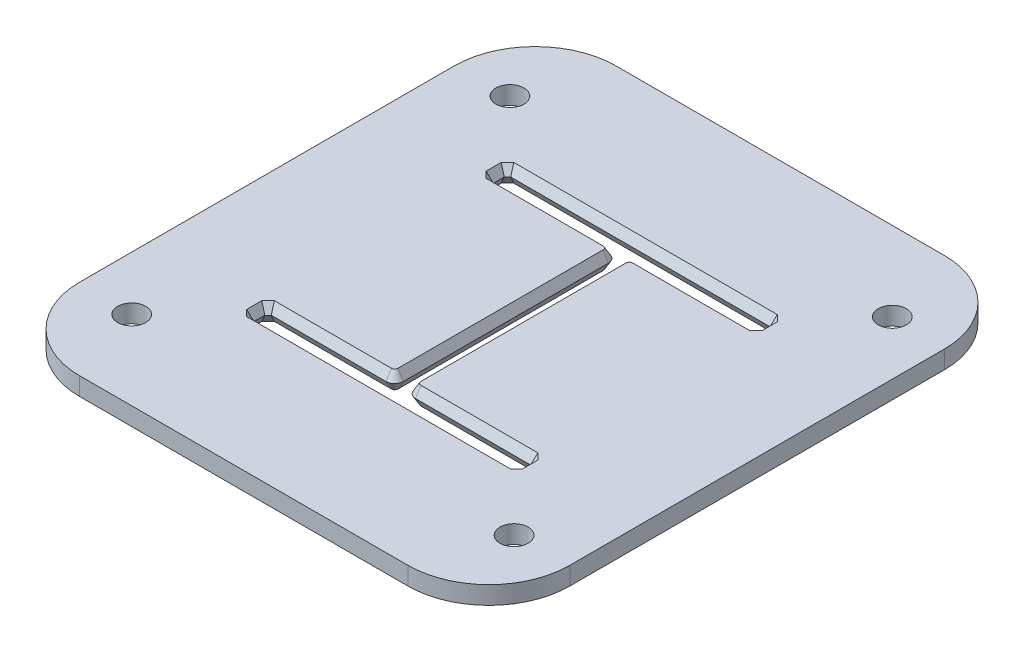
SolidWorks part; units mm, degrees
ref_plane "Front Plane" through (0, 0, 0) normal (0, 0, 1) x (1, 0, 0)
ref_plane "Top Plane" through (0, 0, 0) normal (0, 1, 0) x (1, 0, 0)
ref_plane "Right Plane" through (0, 0, 0) normal (1, 0, 0) x (0, 0, -1)
sketch "w14x665 hole layout" plane through (0, 0, 0) normal (0, 1, 0) x (1, 0, 0)
  point P0 (0, 0)
  line B0 (-308.3103, 362.8701) -> (308.3103, -362.8701) construction
  circle B1 centre (-308.3103, 362.8701) radius 45.2438
  circle B2 centre (0, 400.2851) radius 45.2437
  circle B3 centre (308.3103, 362.8701) radius 45.2438
  circle B4 centre (-308.3103, -362.8701) radius 45.2438
  circle B5 centre (0, -400.2851) radius 45.2437
  circle B6 centre (-161.3981, 0) radius 45.2438
  circle B7 centre (161.3981, 0) radius 45.2438
  circle B8 centre (308.3103, -362.8701) radius 45.2438
  line B9 (-308.3103, -362.8701) -> (308.3103, -362.8701) construction
sketch_block_instance "Block1-1"
sketch_block "Block1" parameters "D1"=90.4875, "D2"=90.4875, "D3"=90.4875, "D4"=90.4875, "D5"=90.4875, "D6"=90.4875, "D7"=90.4875, "D8"=90.4875
sketch "sk w14x550" plane through (0, 0, 0) normal (0, 1, 0) x (1, 0, 0)
  point P0 (-218.44, -257.048)
  line B0 (-218.44, -257.048) -> (-218.44, -160.02)
  line B1 (-218.44, -160.02) -> (-45.466, -160.02)
  line B2 (-30.226, -144.78) -> (-30.226, 144.78)
  line B3 (-45.466, 160.02) -> (-218.44, 160.02)
  line B4 (-218.44, 160.02) -> (-218.44, 257.048)
  line B5 (-218.44, 257.048) -> (218.44, 257.048)
  line B6 (218.44, 257.048) -> (218.44, 160.02)
  line B7 (218.44, 160.02) -> (45.466, 160.02)
  line B8 (30.226, 144.78) -> (30.226, -144.78)
  line B9 (45.466, -160.02) -> (218.44, -160.02)
  line B10 (218.44, -160.02) -> (218.44, -257.048)
  line B11 (218.44, -257.048) -> (-218.44, -257.048)
  line B12 (0, -257.048) -> (0, 257.048) construction
  arc B13 (-45.466, -160.02) -> (-30.226, -144.78) centre (-45.466, -144.78) ccw
  arc B14 (-30.226, 144.78) -> (-45.466, 160.02) centre (-45.466, 144.78) ccw
  arc B15 (45.466, 160.02) -> (30.226, 144.78) centre (45.466, 144.78) ccw
  arc B16 (30.226, -144.78) -> (45.466, -160.02) centre (45.466, -144.78) ccw
sketch_block_instance "W14x550-1"
sketch_block "W14x550" parameters "D6"=15.24, "D1"=60.452, "D2"=436.88, "D3"=514.096, "D4"=97.028, "D5"=97.028, "D7"=30.226
sketch "sk w455"
sketch_block_instance "W14x455-1"
sketch_block "W14x455" parameters "D6"=15.24, "D1"=51.181, "D2"=427.609, "D3"=483.108, "D4"=81.534, "D5"=81.534, "D7"=25.5905
sketch "sk w370" plane through (0, 0, 0) normal (0, 1, 0) x (1, 0, 0)
  line L0 (-209.2325, 227.584) -> (209.2325, -227.584) construction
  point P2 (0, 0)
  line B0 (-209.2325, -227.584) -> (-209.2325, -160.02)
  line B1 (-209.2325, -160.02) -> (-36.2585, -160.02)
  line B2 (-21.0185, -144.78) -> (-21.0185, 144.78)
  line B3 (-36.2585, 160.02) -> (-209.2325, 160.02)
  line B4 (-209.2325, 160.02) -> (-209.2325, 227.584)
  line B5 (-209.2325, 227.584) -> (209.2325, 227.584)
  line B6 (209.2325, 227.584) -> (209.2325, 160.02)
  line B7 (209.2325, 160.02) -> (36.2585, 160.02)
  line B8 (21.0185, 144.78) -> (21.0185, -144.78)
  line B9 (36.2585, -160.02) -> (209.2325, -160.02)
  line B10 (209.2325, -160.02) -> (209.2325, -227.584)
  line B11 (209.2325, -227.584) -> (-209.2325, -227.584)
  line B12 (0, -406.2251) -> (0, 227.584) construction
  arc B13 (-36.2585, -160.02) -> (-21.0185, -144.78) centre (-36.2585, -144.78) ccw
  arc B14 (-21.0185, 144.78) -> (-36.2585, 160.02) centre (-36.2585, 144.78) ccw
  arc B15 (36.2585, 160.02) -> (21.0185, 144.78) centre (36.2585, 144.78) ccw
  arc B16 (21.0185, -144.78) -> (36.2585, -160.02) centre (36.2585, -144.78) ccw
sketch_block_instance "W14x370-1"
sketch_block "W14x370" parameters "D6"=15.24, "D1"=42.037, "D2"=418.465, "D3"=455.168, "D4"=67.564, "D5"=67.564, "D7"=21.0185
sketch "sk w283" plane through (0, 0, 0) normal (0, 1, 0) x (1, 0, 0)
  line L0 (-204.597, 212.598) -> (204.597, -212.598) construction
  point P2 (0, 0)
  line B0 (-204.597, -212.598) -> (-204.597, -160.02)
  line B1 (-204.597, -160.02) -> (-31.623, -160.02)
  line B2 (-16.383, -144.78) -> (-16.383, 144.78)
  line B3 (-31.623, 160.02) -> (-204.597, 160.02)
  line B4 (-204.597, 160.02) -> (-204.597, 212.598)
  line B5 (-204.597, 212.598) -> (204.597, 212.598)
  line B6 (204.597, 212.598) -> (204.597, 160.02)
  line B7 (204.597, 160.02) -> (31.623, 160.02)
  line B8 (16.383, 144.78) -> (16.383, -144.78)
  line B9 (31.623, -160.02) -> (204.597, -160.02)
  line B10 (204.597, -160.02) -> (204.597, -212.598)
  line B11 (204.597, -212.598) -> (-204.597, -212.598)
  line B12 (0, -296.4001) -> (0, 212.598) construction
  arc B13 (-31.623, -160.02) -> (-16.383, -144.78) centre (-31.623, -144.78) ccw
  arc B14 (-16.383, 144.78) -> (-31.623, 160.02) centre (-31.623, 144.78) ccw
  arc B15 (31.623, 160.02) -> (16.383, 144.78) centre (31.623, 144.78) ccw
  arc B16 (16.383, -144.78) -> (31.623, -160.02) centre (31.623, -144.78) ccw
sketch_block_instance "W14x283-1"
sketch_block "W14x283" parameters "D6"=15.24, "D1"=32.766, "D2"=409.194, "D3"=425.196, "D4"=52.578, "D5"=52.578, "D7"=16.383
sketch "sk w193" plane through (0, 0, 0) normal (0, 1, 0) x (1, 0, 0)
  line B0 (-199.517, -196.596) -> (-199.517, -160.02)
  line B1 (-199.517, -160.02) -> (-26.543, -160.02)
  line B2 (-11.303, -144.78) -> (-11.303, 144.78)
  line B3 (-26.543, 160.02) -> (-199.517, 160.02)
  line B4 (-199.517, 160.02) -> (-199.517, 196.596)
  line B5 (-199.517, 196.596) -> (199.517, 196.596)
  line B6 (199.517, 196.596) -> (199.517, 160.02)
  line B7 (199.517, 160.02) -> (26.543, 160.02)
  line B8 (11.303, 144.78) -> (11.303, -144.78)
  line B9 (26.543, -160.02) -> (199.517, -160.02)
  line B10 (199.517, -160.02) -> (199.517, -196.596)
  line B11 (199.517, -196.596) -> (-199.517, -196.596)
  line B12 (0, -196.596) -> (0, 196.596) construction
  arc B13 (-26.543, -160.02) -> (-11.303, -144.78) centre (-26.543, -144.78) ccw
  arc B14 (-11.303, 144.78) -> (-26.543, 160.02) centre (-26.543, 144.78) ccw
  arc B15 (26.543, 160.02) -> (11.303, 144.78) centre (26.543, 144.78) ccw
  arc B16 (11.303, -144.78) -> (26.543, -160.02) centre (26.543, -144.78) ccw
sketch_block_instance "W14x193-1"
sketch_block "W14x193" parameters "D6"=15.24, "D1"=22.606, "D2"=399.034, "D3"=393.192, "D4"=36.576, "D5"=36.576, "D7"=11.303
sketch "sk w90"
sketch_block_instance "w14x90-1"
sketch_block "w14x90"
sketch "hole pattern" plane through (0, 0, 0) normal (0, 1, 0) x (1, 0, 0)
  circle A1 centre (269.9222, 267.0012) radius 76.2 construction
  circle A2 centre (-269.9222, -267.0012) radius 76.2 construction
  circle A3 centre (0, 302.5612) radius 76.2 construction
  circle A4 centre (0, -302.5612) radius 76.2 construction
  circle A5 centre (-161.544, 0) radius 76.2 construction
  circle A6 centre (161.544, 0) radius 76.2 construction
  line B0 (-269.9222, 267.0012) -> (-193.7222, 267.0012)
  line B1 (-269.9222, 267.0012) -> (-199.517, 196.596)
  circle B2 centre (-269.9222, 267.0012) radius 76.2 construction
  line B3 (269.9222, -267.0012) -> (193.7222, -267.0012)
  circle B4 centre (269.9222, -267.0012) radius 76.2 construction
  dimension "D1" = 152.4
  dimension "D2" = 152.4
  dimension "D3" = 152.4
  dimension "D4" = 152.4
  dimension "D7" = 152.4
  dimension "D8" = 152.4
  dimension "D5" = 35.56
  dimension "D6" = 35.56
  dimension "D9" = 161.544
  dimension "D10" = 323.088
sketch_block_instance "Block3-1"
sketch_block "Block3" parameters "D1"=152.4, "D2"=45, "D3"=99.568
sketch_block_instance "Block3-2"
sketch "Sketch2" plane through (0, 0, 0) normal (0, 1, 0) x (1, 0, 0)
  line L0 (-218.8845, 238.2701) -> (-210.5206, 246.634)
  line L1 (210.5206, 246.634) -> (218.8845, 238.2701)
  line L2 (-218.8845, 163.3039) -> (-210.5206, 154.94)
  line L3 (210.5206, 154.94) -> (218.8845, 163.3039)
  line L4 (210.5206, -154.94) -> (218.8845, -163.3039)
  line L5 (218.8845, -238.2701) -> (210.5206, -246.634)
  line L6 (-210.5206, -154.94) -> (-218.8845, -163.3039)
  line L7 (-218.8845, -238.2701) -> (-210.5206, -246.634)
  line L20 (-213.8045, 241.554) -> (213.8045, 241.554) construction
  line L34 (218.8845, -246.634) -> (218.8845, -154.94)
  line L35 (-218.8845, -154.94) -> (-218.8845, -246.634)
  line L48 (-218.8845, -246.634) -> (218.8845, -246.634)
  line L49 (218.8845, -154.94) -> (40.8305, -154.94)
  line L50 (-40.8305, -154.94) -> (-218.8845, -154.94)
  line L51 (30.6705, -144.78) -> (30.6705, 144.78)
  line L52 (-30.6705, 144.78) -> (-30.6705, -144.78)
  line L53 (-218.8845, 154.94) -> (-40.8305, 154.94)
  line L54 (-218.8845, 246.634) -> (-218.8845, 154.94)
  line L55 (218.8845, 246.634) -> (-218.8845, 246.634)
  line L56 (218.8845, 154.94) -> (218.8845, 246.634)
  line L57 (40.8305, 154.94) -> (218.8845, 154.94)
  line L58 (218.8845, -238.2701) -> (218.8845, -163.3039)
  line L59 (-218.8845, -163.3039) -> (-218.8845, -238.2701)
  line L60 (-210.5206, -246.634) -> (210.5206, -246.634)
  line L61 (210.5206, -154.94) -> (40.8305, -154.94)
  line L62 (-40.8305, -154.94) -> (-210.5206, -154.94)
  line L63 (30.6705, -144.78) -> (30.6705, 144.78)
  line L64 (-30.6705, 144.78) -> (-30.6705, -144.78)
  line L65 (-210.5206, 154.94) -> (-40.8305, 154.94)
  line L66 (-218.8845, 238.2701) -> (-218.8845, 163.3039)
  line L67 (210.5206, 246.634) -> (-210.5206, 246.634)
  line L68 (218.8845, 163.3039) -> (218.8845, 238.2701)
  line L69 (40.8305, 154.94) -> (210.5206, 154.94)
  arc A16 (30.6705, -144.78) -> (40.8305, -154.94) centre (40.8305, -144.78) ccw
  arc A17 (-40.8305, -154.94) -> (-30.6705, -144.78) centre (-40.8305, -144.78) ccw
  arc A18 (-30.6705, 144.78) -> (-40.8305, 154.94) centre (-40.8305, 144.78) ccw
  arc A19 (40.8305, 154.94) -> (30.6705, 144.78) centre (40.8305, 144.78) ccw
  arc A20 (30.6705, -144.78) -> (40.8305, -154.94) centre (40.8305, -144.78) ccw
  arc A21 (-40.8305, -154.94) -> (-30.6705, -144.78) centre (-40.8305, -144.78) ccw
  arc A22 (-30.6705, 144.78) -> (-40.8305, 154.94) centre (-40.8305, 144.78) ccw
  arc A23 (40.8305, 154.94) -> (30.6705, 144.78) centre (40.8305, 144.78) ccw
  dimension "D2" = 5.08
  dimension "D3" = 1.27
  dimension "D4" = 1.27
  dimension "D5" = 1.27
  dimension "D6" = 1.27
  dimension "D7" = 1.27
  dimension "D8" = 1.27
  dimension "D9" = 1.27
  dimension "D10" = 1.27
  dimension "D11" = 45
sketch "Sketch4" plane through (0, 0, 0) normal (0, 1, 0) x (1, 0, 0)
  line L1 (-403.008, 494.9829) -> (403.008, 494.9829)
  line L2 (-403.008, 494.9829) -> (-403.008, -494.9829)
  line L3 (-403.008, -494.9829) -> (403.008, -494.9829)
  line L4 (403.008, 494.9829) -> (403.008, -494.9829)
  point P4 (-403.008, 0)
  point P5 (0, 494.9829)
  dimension "D1" = 989.9658
  dimension "D2" = 806.016
extrude "Boss-Extrude1" add sketch "Sketch4" along normal mid plane 25.4
extrude "W455" [suppressed] cut sketch "Sketch2" against normal mid plane 63.5 draft 30
sketch "Sketch13" plane through (0, 0, 0) normal (0, 1, 0) x (1, 0, 0)
  line L12 (-214.3125, 224.3001) -> (-205.9486, 232.664)
  line L13 (205.9486, 232.664) -> (214.3125, 224.3001)
  line L14 (-214.3125, 163.3039) -> (-205.9486, 154.94)
  line L15 (205.9486, 154.94) -> (214.3125, 163.3039)
  line L16 (-205.9486, -154.94) -> (-214.3125, -163.3039)
  line L17 (-214.3125, -224.3001) -> (-205.9486, -232.664)
  line L18 (205.9486, -154.94) -> (214.3125, -163.3039)
  line L19 (214.3125, -224.3001) -> (205.9486, -232.664)
  line L24 (214.3125, -232.664) -> (214.3125, -154.94)
  line L25 (214.3125, -154.94) -> (36.2585, -154.94)
  line L26 (-214.3125, -232.664) -> (214.3125, -232.664)
  line L27 (-214.3125, -154.94) -> (-214.3125, -232.664)
  line L28 (-36.2585, -154.94) -> (-214.3125, -154.94)
  line L29 (26.0985, -144.78) -> (26.0985, 144.78)
  line L30 (-26.0985, 144.78) -> (-26.0985, -144.78)
  line L31 (-214.3125, 154.94) -> (-36.2585, 154.94)
  line L32 (-214.3125, 232.664) -> (-214.3125, 154.94)
  line L33 (214.3125, 232.664) -> (-214.3125, 232.664)
  line L34 (214.3125, 154.94) -> (214.3125, 232.664)
  line L35 (36.2585, 154.94) -> (214.3125, 154.94)
  line L36 (214.3125, -224.3001) -> (214.3125, -163.3039)
  line L37 (205.9486, -154.94) -> (36.2585, -154.94)
  line L38 (-205.9486, -232.664) -> (205.9486, -232.664)
  line L39 (-214.3125, -163.3039) -> (-214.3125, -224.3001)
  line L40 (-36.2585, -154.94) -> (-205.9486, -154.94)
  line L41 (26.0985, -144.78) -> (26.0985, 144.78)
  line L42 (-26.0985, 144.78) -> (-26.0985, -144.78)
  line L43 (-205.9486, 154.94) -> (-36.2585, 154.94)
  line L44 (-214.3125, 224.3001) -> (-214.3125, 163.3039)
  line L45 (205.9486, 232.664) -> (-205.9486, 232.664)
  line L46 (214.3125, 163.3039) -> (214.3125, 224.3001)
  line L47 (36.2585, 154.94) -> (205.9486, 154.94)
  arc A8 (26.0985, -144.78) -> (36.2585, -154.94) centre (36.2585, -144.78) ccw
  arc A9 (-36.2585, -154.94) -> (-26.0985, -144.78) centre (-36.2585, -144.78) ccw
  arc A10 (36.2585, 154.94) -> (26.0985, 144.78) centre (36.2585, 144.78) ccw
  arc A11 (-26.0985, 144.78) -> (-36.2585, 154.94) centre (-36.2585, 144.78) ccw
  arc A12 (26.0985, -144.78) -> (36.2585, -154.94) centre (36.2585, -144.78) ccw
  arc A13 (-36.2585, -154.94) -> (-26.0985, -144.78) centre (-36.2585, -144.78) ccw
  arc A14 (36.2585, 154.94) -> (26.0985, 144.78) centre (36.2585, 144.78) ccw
  arc A15 (-26.0985, 144.78) -> (-36.2585, 154.94) centre (-36.2585, 144.78) ccw
  dimension "D2" = 45
  dimension "D3" = 1.27
  dimension "D4" = 1.27
  dimension "D5" = 1.27
  dimension "D6" = 1.27
  dimension "D7" = 1.27
  dimension "D8" = 1.27
  dimension "D9" = 1.27
  dimension "D10" = 1.27
  dimension "D1" = 5.08
extrude "w370" [suppressed] cut sketch "Sketch13" against normal mid plane 76.2 draft 30
sketch "Sketch15" plane through (0, 0, 0) normal (0, 1, 0) x (1, 0, 0)
  line L13 (-201.3131, 217.678) -> (-209.677, 209.3141)
  line L14 (201.3131, 217.678) -> (209.677, 209.3141)
  line L15 (209.677, 163.3039) -> (201.3131, 154.94)
  line L16 (-209.677, 163.3039) -> (-201.3131, 154.94)
  line L17 (-201.3131, -154.94) -> (-209.677, -163.3039)
  line L18 (201.3131, -154.94) -> (209.677, -163.3039)
  line L19 (209.677, -209.3141) -> (201.3131, -217.678)
  line L20 (-209.677, -209.3141) -> (-201.3131, -217.678)
  line L25 (209.677, -217.678) -> (209.677, -154.94)
  line L26 (209.677, -154.94) -> (31.623, -154.94)
  line L27 (-209.677, -217.678) -> (209.677, -217.678)
  line L28 (-209.677, -154.94) -> (-209.677, -217.678)
  line L29 (-31.623, -154.94) -> (-209.677, -154.94)
  line L30 (21.463, -144.78) -> (21.463, 144.78)
  line L31 (-21.463, 144.78) -> (-21.463, -144.78)
  line L32 (-209.677, 154.94) -> (-31.623, 154.94)
  line L33 (-209.677, 217.678) -> (-209.677, 154.94)
  line L34 (209.677, 217.678) -> (-209.677, 217.678)
  line L35 (209.677, 154.94) -> (209.677, 217.678)
  line L36 (31.623, 154.94) -> (209.677, 154.94)
  line L37 (209.677, -209.3141) -> (209.677, -163.3039)
  line L38 (201.3131, -154.94) -> (31.623, -154.94)
  line L39 (-201.3131, -217.678) -> (201.3131, -217.678)
  line L40 (-209.677, -163.3039) -> (-209.677, -209.3141)
  line L41 (-31.623, -154.94) -> (-201.3131, -154.94)
  line L42 (21.463, -144.78) -> (21.463, 144.78)
  line L43 (-21.463, 144.78) -> (-21.463, -144.78)
  line L44 (-201.3131, 154.94) -> (-31.623, 154.94)
  line L45 (-209.677, 209.3141) -> (-209.677, 163.3039)
  line L46 (201.3131, 217.678) -> (-201.3131, 217.678)
  line L47 (209.677, 163.3039) -> (209.677, 209.3141)
  line L48 (31.623, 154.94) -> (201.3131, 154.94)
  arc A8 (21.463, -144.78) -> (31.623, -154.94) centre (31.623, -144.78) ccw
  arc A9 (-31.623, -154.94) -> (-21.463, -144.78) centre (-31.623, -144.78) ccw
  arc A10 (31.623, 154.94) -> (21.463, 144.78) centre (31.623, 144.78) ccw
  arc A11 (-21.463, 144.78) -> (-31.623, 154.94) centre (-31.623, 144.78) ccw
  arc A12 (21.463, -144.78) -> (31.623, -154.94) centre (31.623, -144.78) ccw
  arc A13 (-31.623, -154.94) -> (-21.463, -144.78) centre (-31.623, -144.78) ccw
  arc A14 (31.623, 154.94) -> (21.463, 144.78) centre (31.623, 144.78) ccw
  arc A15 (-21.463, 144.78) -> (-31.623, 154.94) centre (-31.623, 144.78) ccw
  dimension "D2" = 45
  dimension "D3" = 1.27
  dimension "D4" = 1.27
  dimension "D5" = 1.27
  dimension "D6" = 1.27
  dimension "D7" = 1.27
  dimension "D8" = 1.27
  dimension "D9" = 1.27
  dimension "D10" = 1.27
  dimension "D1" = 5.08
extrude "w283" [suppressed] cut sketch "Sketch15" against normal mid plane 50.8 draft 30
sketch "Sketch17" plane through (0, 0, 0) normal (0, 1, 0) x (1, 0, 0)
  line L12 (-196.2331, 201.676) -> (-204.597, 193.3121)
  line L13 (-204.597, 163.3039) -> (-196.2331, 154.94)
  line L14 (196.2331, 201.676) -> (204.597, 193.3121)
  line L15 (204.597, 163.3039) -> (196.2331, 154.94)
  line L16 (-196.2331, -154.94) -> (-204.597, -163.3039)
  line L17 (196.2331, -154.94) -> (204.597, -163.3039)
  line L18 (204.597, -193.3121) -> (196.2331, -201.676)
  line L19 (-204.597, -193.3121) -> (-196.2331, -201.676)
  line L24 (204.597, -154.94) -> (26.543, -154.94)
  line L25 (204.597, -201.676) -> (204.597, -154.94)
  line L26 (-204.597, -201.676) -> (204.597, -201.676)
  line L27 (-204.597, -154.94) -> (-204.597, -201.676)
  line L28 (-26.543, -154.94) -> (-204.597, -154.94)
  line L29 (204.597, 154.94) -> (204.597, 201.676)
  line L30 (26.543, 154.94) -> (204.597, 154.94)
  line L31 (16.383, -144.78) -> (16.383, 144.78)
  line L32 (-16.383, 144.78) -> (-16.383, -144.78)
  line L33 (-204.597, 154.94) -> (-26.543, 154.94)
  line L34 (-204.597, 201.676) -> (-204.597, 154.94)
  line L35 (204.597, 201.676) -> (-204.597, 201.676)
  line L36 (196.2331, -154.94) -> (26.543, -154.94)
  line L37 (204.597, -193.3121) -> (204.597, -163.3039)
  line L38 (-196.2331, -201.676) -> (196.2331, -201.676)
  line L39 (-204.597, -163.3039) -> (-204.597, -193.3121)
  line L40 (-26.543, -154.94) -> (-196.2331, -154.94)
  line L41 (204.597, 163.3039) -> (204.597, 193.3121)
  line L42 (26.543, 154.94) -> (196.2331, 154.94)
  line L43 (16.383, -144.78) -> (16.383, 144.78)
  line L44 (-16.383, 144.78) -> (-16.383, -144.78)
  line L45 (-196.2331, 154.94) -> (-26.543, 154.94)
  line L46 (-204.597, 193.3121) -> (-204.597, 163.3039)
  line L47 (196.2331, 201.676) -> (-196.2331, 201.676)
  arc A8 (16.383, -144.78) -> (26.543, -154.94) centre (26.543, -144.78) ccw
  arc A9 (-26.543, -154.94) -> (-16.383, -144.78) centre (-26.543, -144.78) ccw
  arc A10 (26.543, 154.94) -> (16.383, 144.78) centre (26.543, 144.78) ccw
  arc A11 (-16.383, 144.78) -> (-26.543, 154.94) centre (-26.543, 144.78) ccw
  arc A12 (16.383, -144.78) -> (26.543, -154.94) centre (26.543, -144.78) ccw
  arc A13 (-26.543, -154.94) -> (-16.383, -144.78) centre (-26.543, -144.78) ccw
  arc A14 (26.543, 154.94) -> (16.383, 144.78) centre (26.543, 144.78) ccw
  arc A15 (-16.383, 144.78) -> (-26.543, 154.94) centre (-26.543, 144.78) ccw
  dimension "D2" = 45
  dimension "D3" = 1.27
  dimension "D4" = 1.27
  dimension "D5" = 1.27
  dimension "D6" = 1.27
  dimension "D7" = 1.27
  dimension "D8" = 1.27
  dimension "D9" = 1.27
  dimension "D10" = 1.27
  dimension "D1" = 5.08
extrude "w193" [suppressed] cut sketch "Sketch17" against normal mid plane 50.8 draft 30
sketch "Sketch19" plane through (0, 0, 0) normal (0, 1, 0) x (1, 0, 0)
  line L12 (-187.579, 176.6751) -> (-183.0251, 181.229)
  line L13 (-187.579, 161.3989) -> (-183.0251, 156.845)
  line L14 (183.0251, 181.229) -> (187.579, 176.6751)
  line L15 (183.0251, 156.845) -> (187.579, 161.3989)
  line L16 (183.0251, -156.845) -> (187.579, -161.3989)
  line L17 (183.0251, -181.229) -> (187.579, -176.6751)
  line L18 (-183.0251, -156.845) -> (-187.579, -161.3989)
  line L19 (-187.579, -176.6751) -> (-183.0251, -181.229)
  line L24 (187.579, -181.229) -> (187.579, -156.845)
  line L25 (-187.579, -181.229) -> (187.579, -181.229)
  line L26 (187.579, -156.845) -> (20.828, -156.845)
  line L27 (8.763, -144.78) -> (8.763, 144.78)
  line L28 (-8.763, 144.78) -> (-8.763, -144.78)
  line L29 (-20.828, -156.845) -> (-187.579, -156.845)
  line L30 (-187.579, -156.845) -> (-187.579, -181.229)
  line L31 (20.828, 156.845) -> (187.579, 156.845)
  line L32 (187.579, 156.845) -> (187.579, 181.229)
  line L33 (-187.579, 156.845) -> (-20.828, 156.845)
  line L34 (-187.579, 181.229) -> (-187.579, 156.845)
  line L35 (187.579, 181.229) -> (-187.579, 181.229)
  line L36 (187.579, -176.6751) -> (187.579, -161.3989)
  line L37 (-183.0251, -181.229) -> (183.0251, -181.229)
  line L38 (183.0251, -156.845) -> (20.828, -156.845)
  line L39 (8.763, -144.78) -> (8.763, 144.78)
  line L40 (-8.763, 144.78) -> (-8.763, -144.78)
  line L41 (-20.828, -156.845) -> (-183.0251, -156.845)
  line L42 (-187.579, -161.3989) -> (-187.579, -176.6751)
  line L43 (20.828, 156.845) -> (183.0251, 156.845)
  line L44 (187.579, 161.3989) -> (187.579, 176.6751)
  line L45 (-183.0251, 156.845) -> (-20.828, 156.845)
  line L46 (-187.579, 176.6751) -> (-187.579, 161.3989)
  line L47 (183.0251, 181.229) -> (-183.0251, 181.229)
  arc A8 (8.763, -144.78) -> (20.828, -156.845) centre (20.828, -144.78) ccw
  arc A9 (-20.828, -156.845) -> (-8.763, -144.78) centre (-20.828, -144.78) ccw
  arc A10 (20.828, 156.845) -> (8.763, 144.78) centre (20.828, 144.78) ccw
  arc A11 (-8.763, 144.78) -> (-20.828, 156.845) centre (-20.828, 144.78) ccw
  arc A12 (8.763, -144.78) -> (20.828, -156.845) centre (20.828, -144.78) ccw
  arc A13 (-20.828, -156.845) -> (-8.763, -144.78) centre (-20.828, -144.78) ccw
  arc A14 (20.828, 156.845) -> (8.763, 144.78) centre (20.828, 144.78) ccw
  arc A15 (-8.763, 144.78) -> (-20.828, 156.845) centre (-20.828, 144.78) ccw
  dimension "D2" = 45
  dimension "D3" = 1.27
  dimension "D4" = 1.27
  dimension "D5" = 1.27
  dimension "D6" = 1.27
  dimension "D7" = 1.27
  dimension "D8" = 1.27
  dimension "D9" = 1.27
  dimension "D10" = 1.27
  dimension "D1" = 3.175
extrude "w90" cut sketch "Sketch19" against normal mid plane 50.8 draft 30
sketch "Sketch6" plane through (0, 0, 0) normal (0, 1, 0) x (1, 0, 0)
  circle A0 centre (-269.9222, 267.0012) radius 19.8438
  circle A1 centre (0, 302.5612) radius 26.1938 construction
  circle A2 centre (269.9222, 267.0012) radius 19.8438
  circle A3 centre (-161.544, 0) radius 26.1937 construction
  circle A4 centre (161.544, 0) radius 26.1937 construction
  circle A7 centre (269.9222, -267.0012) radius 19.8438
  circle A14 centre (-269.9222, 267.0012) radius 76.2 construction
  circle A15 centre (0, 302.5612) radius 76.2 construction
  circle A16 centre (0, -302.5612) radius 26.1938 construction
  circle A18 centre (269.9222, 267.0012) radius 76.2 construction
  circle A19 centre (-269.9222, -267.0012) radius 19.8438
  circle A21 centre (-269.9222, -267.0012) radius 76.2 construction
  circle A22 centre (0, -302.5612) radius 76.2 construction
  circle A23 centre (269.9222, -267.0012) radius 76.2 construction
  circle A24 centre (-161.544, 0) radius 76.2 construction
  circle A25 centre (161.544, 0) radius 76.2 construction
  dimension "D1" = 39.6875
  dimension "D2" = 52.3875
  dimension "D3" = 39.6875
  dimension "D4" = 52.3875
  dimension "D5" = 52.3875
  dimension "D6" = 39.6875
  dimension "D7" = 52.3875
  dimension "D8" = 39.6875
extrude "Cut-Extrude2" cut sketch "Sketch6" against normal through all both and the other way through all
sketch "Sketch11" plane through (0, 0, 0) normal (0, 1, 0) x (1, 0, 0)
  line L0 (-231.8222, 378.7612) -> (231.8222, 378.7612)
  line L1 (-231.8222, -378.7612) -> (231.8222, -378.7612)
  line L2 (-346.1222, 264.4612) -> (-346.1222, -264.4612)
  line L3 (346.1222, 264.4612) -> (346.1222, -264.4612)
  line L5 (-611.5624, 602.8787) -> (624.0589, 602.8787)
  line L6 (-611.5624, 602.8787) -> (-611.5624, -644.1484)
  line L7 (-611.5624, -644.1484) -> (624.0589, -644.1484)
  line L8 (624.0589, 602.8787) -> (624.0589, -644.1484)
  circle A0 centre (0, 302.5612) radius 76.2 construction
  circle A1 centre (0, -302.5612) radius 76.2 construction
  circle A2 centre (-269.9222, 267.0012) radius 76.2 construction
  circle A3 centre (269.9222, 267.0012) radius 76.2 construction
  arc A4 (-231.8222, -378.7612) -> (-346.1222, -264.4612) centre (-231.8222, -264.4612) cw
  arc A5 (231.8222, -378.7612) -> (346.1222, -264.4612) centre (231.8222, -264.4612) ccw
  arc A6 (231.8222, 378.7612) -> (346.1222, 264.4612) centre (231.8222, 264.4612) cw
  arc A7 (-346.1222, 264.4612) -> (-231.8222, 378.7612) centre (-231.8222, 264.4612) cw
  dimension "D1" = 114.3
extrude "Cut-Extrude3" cut sketch "Sketch11" against normal through all both and the other way through all
